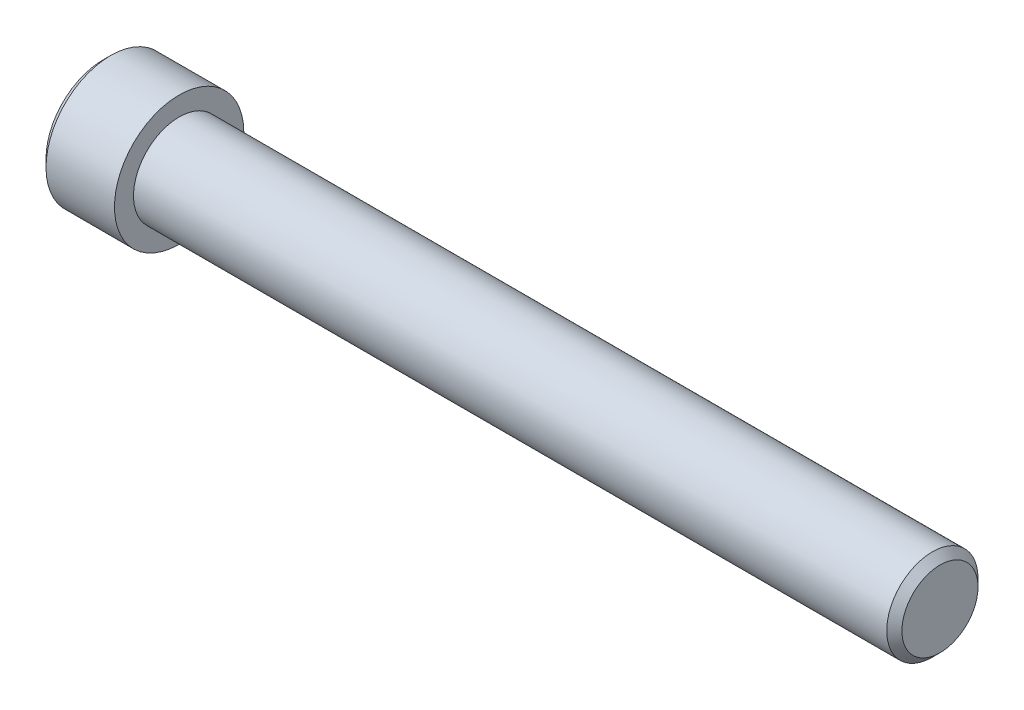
SolidWorks part; units mm, degrees
ref_plane "Front Plane" through (0, 0, 0) normal (0, 0, 1) x (1, 0, 0)
ref_plane "Top Plane" through (0, 0, 0) normal (0, 1, 0) x (1, 0, 0)
ref_plane "Right Plane" through (0, 0, 0) normal (1, 0, 0) x (0, 0, -1)
imported_body "Imported3"
sketch "Sketch1" plane through (-5, 0, 0) normal (1, 0, 0) x (0, 0, -1)
  circle A0 centre (0, 0) radius 3
  dimension "D1" = 6
extrude "Boss-Extrude1" add sketch "Sketch1" along normal blind 50
chamfer "Chamfer1" distance 0.5 angle 45 2 edges at (45, 0, -3) (-10, 0, 4.25)
